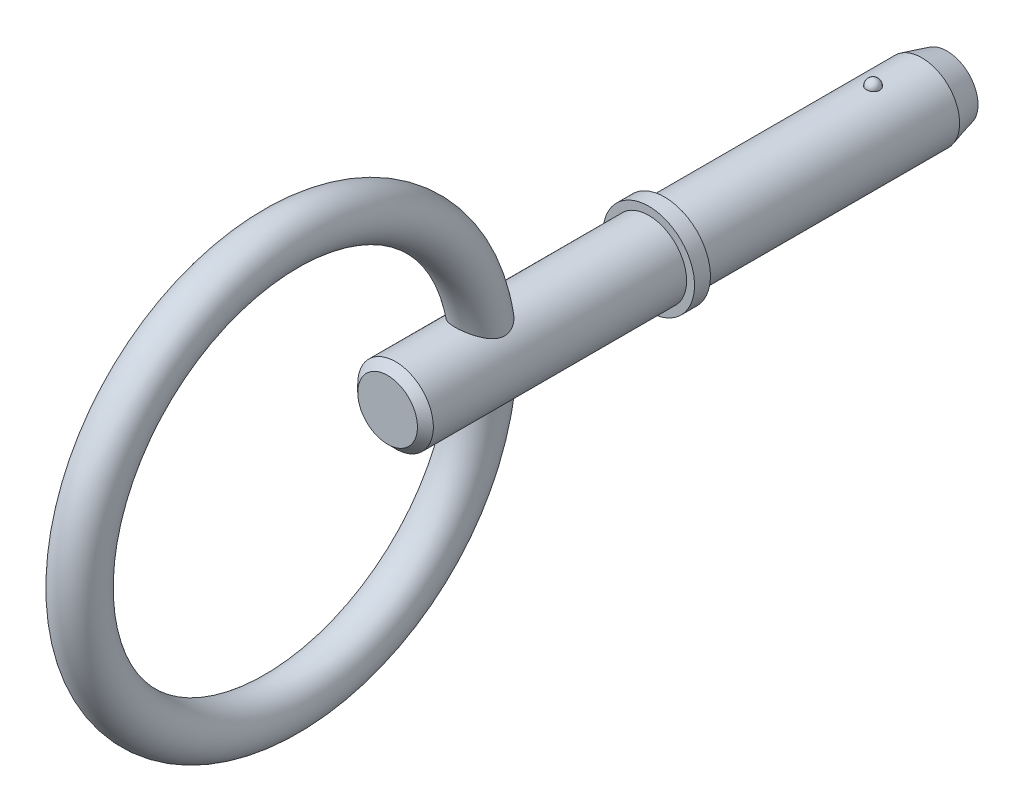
SolidWorks part; units mm, degrees
ref_plane "Front Plane" through (0, 0, 0) normal (0, 0, 1) x (1, 0, 0)
ref_plane "Top Plane" through (0, 0, 0) normal (0, 1, 0) x (1, 0, 0)
ref_plane "Right Plane" through (0, 0, 0) normal (1, 0, 0) x (0, 0, -1)
sketch "Sketch2" plane through (0, 0, 0) normal (0, 0, 1) x (1, 0, 0)
  circle A0 centre (0, 0) radius 2.38
  point P3 (0, 2.38)
  dimension "D1" = 4.76
extrude "Boss-Extrude1" add sketch "Sketch2" along normal blind 12.7
sketch "Sketch3" plane through (0, 0, 0) normal (0, 0, -1) x (-1, 0, 0)
  circle A0 centre (0, 0) radius 2.38
  dimension "D1" = 4.76
extrude "Boss-Extrude2" add sketch "Sketch3" along normal blind 5.08
chamfer "Chamfer1" distance 1.586 angle 15 1 edges at (-2.38, 0, -5.08)
sketch "Sketch18" plane through (0, 0, 0) normal (1, 0, 0) x (0, 0, -1)
  line L0 (3.494, 2.38) -> (-12.7, 2.38) construction
  line L1 (0.42, 2.8) -> (0.42, 1.96)
  line L2 (-12.7, -2.38) -> (3.494, -2.38) construction
  arc A0 (0.42, 2.8) -> (0.42, 1.96) centre (0.42, 2.38) ccw
  point P4 (0, 2.38)
  dimension "D1" = 5.18
revolve "Revolve1" add sketch "Sketch18" angle 360 about L1
sketch "Sketch19" plane through (0, 0, 0) normal (1, 0, 0) x (0, 0, -1)
  line L0 (-33.7288, 0) -> (-46.4542, 0) construction
sketch "Sketch20" plane through (0, 0, 0) normal (1, 0, 0) x (0, 0, -1)
  line L0 (-12.7, 0) -> (-12.7, 2.88)
  line L1 (-12.7, 2.38) -> (-12.7, -2.38) construction
  line L2 (-12.7, 2.88) -> (-13.7, 2.88)
  line L3 (-13.7, 2.88) -> (-13.7, 0)
  line L4 (-33.7288, 0) -> (-46.4542, 0) construction
  line L5 (-13.7, 0) -> (-12.7, 0)
  dimension "D1" = 2.88
  dimension "D2" = 1
revolve "Revolve2" add sketch "Sketch20" angle 360 about L0
sketch "Sketch21" plane through (0, 0, 12.7) normal (0, 0, -1) x (-1, 0, 0)
  circle A0 centre (0, 0) radius 2.38
  dimension "D1" = 4.76
extrude "Boss-Extrude3" add sketch "Sketch21" against normal blind 17.45
chamfer "Chamfer2" distance 0.5 angle 45 1 edges at (-2.38, 0, 30.15)
sketch "Sketch23" plane through (0, 0, 0) normal (1, 0, 0) x (0, 0, -1)
  line L0 (-30.15, 1.88) -> (-30.15, -1.88) construction
  circle A0 centre (-36.85, 0) radius 12.7
  point P2 (-24.15, 0)
  dimension "D1" = 25.4
  dimension "D2" = 6
sketch "Sketch24" plane through (0, 0, 0) normal (0, 1, 0) x (1, 0, 0)
  circle A0 centre (0, -24.15) radius 1.5
  dimension "D1" = 3
sweep "Sweep1" add profiles "Sketch24" path "Sketch23"
